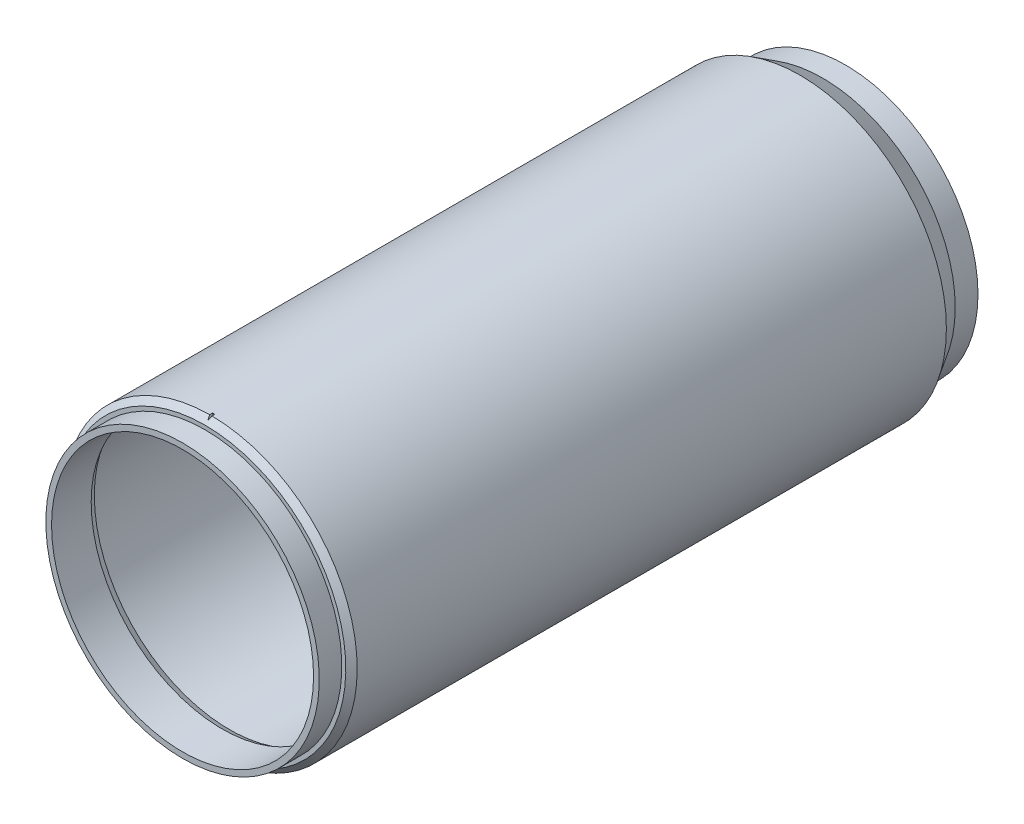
SolidWorks part; units mm, degrees
ref_plane "Front Plane" through (0, 0, 0) normal (0, 0, 1) x (1, 0, 0)
ref_plane "Top Plane" through (0, 0, 0) normal (0, 1, 0) x (1, 0, 0)
ref_plane "Right Plane" through (0, 0, 0) normal (1, 0, 0) x (0, 0, -1)
sketch "Sketch1" plane through (0, 0, 0) normal (0, 0, 1) x (1, 0, 0)
  circle A0 centre (0, 0) radius 95.25
  circle A1 centre (0, 0) radius 73.025
  dimension "D1" = 190.5
  dimension "D2" = 146.05
  dimension "D3" = 22.225
extrude "Extrude1" add sketch "Sketch1" along normal blind 378.6886
sketch "Sketch11" plane through (0, 0, 0) normal (1, 0, 0) x (0, 0, -1)
  line L1 (0, -95.25) -> (0, 95.25) construction
  line L2 (0, 58.549) -> (-3.8438, 57.15)
  line L3 (-3.8438, 57.15) -> (-23.495, 57.15)
  line L5 (-39.37, 92.6205) -> (0, 92.6205)
  line L7 (0, 0) -> (35.4678, 0) construction
  line L10 (-23.495, 57.15) -> (-39.37, 73.025)
  line L11 (0, 73.025) -> (-378.6886, 73.025) construction
  line L12 (-39.37, 73.025) -> (-39.37, 92.6205)
  line L13 (0, 92.6205) -> (0, 58.549)
  dimension "D1" = 39.37
  dimension "D2" = 114.3
  dimension "D4" = 45
  dimension "D5" = 20
revolve "Revolve1" add sketch "Sketch11" angle 360 about L7
sketch "Sketch4" plane through (0, 0, 0) normal (-1, 0, 0) x (0, 0, -1)
  line L1 (0, 95.25) -> (-378.6886, 95.25) construction
  line L2 (0, 81.5975) -> (-366.1156, 81.5975)
  line L3 (-366.1156, 81.5975) -> (-366.1156, 76.2)
  line L7 (0, 0) -> (-51.7665, 0) construction
  line L8 (-378.6886, 76.2) -> (-378.6886, 95.25)
  line L9 (-378.6886, 95.25) -> (-284.1625, 95.25)
  line L10 (-276.225, 95.25) -> (0, 95.25)
  line L11 (-369.3787, -73.025) -> (-381, -73.025) construction
  line L12 (-27.2857, -81.5975) -> (-366.1156, -81.5975) construction
  line L13 (-378.6886, 76.2) -> (-366.1156, 76.2)
  line L14 (-276.225, 95.25) -> (-284.1625, 95.25)
  line L16 (0, 95.25) -> (-378.6886, 95.25) construction
  line L18 (0, 81.5975) -> (0, 95.25)
  dimension "D1" = 163.195
  dimension "D2" = 12.573
  dimension "D7" = 152.4
revolve "Cut-Revolve1" cut sketch "Sketch4" angle 360 about L7
chamfer "Chamfer2" distance 3.175 angle 45 1 edges at (0, 81.5975, 366.1156)
sketch "Sketch7" [suppressed] plane through (0, 0, 0) normal (0, 0, 1) x (1, 0, 0)
  line L1 (-127.1207, 123.9041) -> (142.6954, 123.9041)
  line L2 (-127.1207, 123.9041) -> (-127.1207, -118.2423)
  line L3 (-127.1207, -118.2423) -> (142.6954, -118.2423)
  line L4 (142.6954, 123.9041) -> (142.6954, -118.2423)
extrude "FEA Cut" [suppressed] cut sketch "Sketch7" along normal blind 151.9089
sketch3d "CenterOfMass 10/16/2008 15:09:58"
  point P0 (0, 0, 147.9265)
sketch "Sketch12" plane through (0, 0, 0) normal (1, 0, 0) x (0, 0, -1)
  line L0 (0, 0) -> (30.6984, 0) construction
  line L2 (-9.1186, 50.4324) -> (0, 50.4324)
  line L3 (-9.1186, 50.4324) -> (-9.1186, 81.5975)
  line L4 (-9.1186, 81.5975) -> (0, 81.5975)
  line L5 (0, 50.4324) -> (0, 81.5975)
  dimension "D1" = 9.1186
revolve "Cut-Revolve2" cut sketch "Sketch12" angle 360 about L0
sketch "Sketch16" plane through (0, 0, 0) normal (1, 0, 0) x (0, 0, -1)
  line L0 (-356.5906, 73.025) -> (-352.4662, 75.4062)
  line L1 (-39.37, 73.025) -> (-378.6886, 73.025) construction
  line L2 (-352.4662, 75.4062) -> (-41.7512, 75.4062)
  line L3 (-41.7512, 75.4062) -> (-39.37, 73.025)
  line L4 (-39.37, 73.025) -> (-356.5906, 73.025)
  line L5 (-23.495, 57.15) -> (-39.37, 73.025) construction
  line L6 (-366.1156, 78.4225) -> (-366.1156, -78.4225) construction
  line L7 (0, 0) -> (-59.6395, 0) construction
  dimension "D1" = 30
  dimension "D2" = 9.525
  dimension "D3" = 150.8125
hole_wizard "#10-32 Tapped Hole1" positions "Sketch14" profile "Sketch13" tap size "#10-32" standard "ANSI Inch"
sketch "Sketch14" plane through (0, 0, 9.1186) normal (0, 0, -1) x (-1, 0, 0)
  circle A0 centre (0, 0) radius 66.675 construction
  point P0 (0, 66.675)
  dimension "D1" = 133.35
sketch "Sketch13" plane through (0, 66.675, 9.1186) normal (1, 0, 0) x (0, 1, 0)
  line L0 (0, 0) -> (0, 13.2783)
  line L1 (0, 13.2783) -> (2.0193, 12.065)
  line L2 (2.0193, 12.065) -> (2.0193, 0)
  line L5 (2.0193, 0) -> (0, 0)
  line L10 (0, 13.2783) -> (-2.0193, 12.065) construction
  line L11 (0, -6.35) -> (0, 107.95) construction
  dimension "Tap Drill Dia." = 4.0386
  dimension "Tap Drill Depth" = 12.065
  dimension "Drill Angle" = 118
pattern_circular "CirPattern1" count 8 over 360 about axis through (0, 0, 0) along (0, 0, 1) of "#10-32 Tapped Hole1"
sketch "Sketch15" plane through (0, 0, 0) normal (1, 0, 0) x (0, 0, -1)
  line L0 (-9.1186, 73.8188) -> (-34.5186, 81.5975) construction
  line L1 (-9.1186, -81.5975) -> (-9.1186, 81.5975) construction
  line L2 (-9.1186, 81.5975) -> (-362.9406, 81.5975) construction
  line L3 (-34.5186, 81.5975) -> (-9.1186, 81.5975)
  line L4 (-9.1186, 81.5975) -> (-9.1186, 73.8188)
  line L5 (0, 0) -> (27.4443, 0) construction
  line L6 (-9.1186, 73.8188) -> (-21.8186, 73.8188)
  line L7 (-21.8186, 73.8188) -> (-34.5186, 81.5975)
  dimension "D1" = 147.6375
  dimension "D2" = 25.4
  dimension "D3" = 12.7
  dimension "D4" = 31.487
revolve "Cut-Revolve3" cut sketch "Sketch15" angle 360 about L5
revolve "Cut-Revolve4" cut sketch "Sketch16" angle 360 about L7
sketch "Sketch17" plane through (0, 0, 0) normal (0, 0, 1) x (1, 0, 0)
  line L1 (0, 0) -> (-86.2333, 0)
  line L2 (0, 0) -> (0, 88.0376)
  line L3 (0, 88.0376) -> (-86.2333, 88.0376)
  line L4 (-86.2333, 0) -> (-86.2333, 88.0376)
extrude "FEA Cut-Extrude1" [suppressed] cut sketch "Sketch17" along normal through all flip side to cut
sketch "Sketch18" plane through (0, 0, 366.1156) normal (0, 0, 1) x (1, 0, 0)
  line L0 (-1.5706, 83.789) -> (0, 79.9973)
  line L1 (0, 79.9973) -> (1.5706, 83.789)
  line L2 (1.5706, 83.789) -> (-1.5706, 83.789)
  line L3 (0, 79.9973) -> (0, 83.789) construction
  circle A0 centre (0, 0) radius 81.5975 construction
  dimension "D1" = 79.9973
  dimension "D2" = 1.6002
  dimension "D3" = 45
extrude "Cut-Extrude2" cut sketch "Sketch18" against normal blind 4.7625
chamfer "Chamfer3" distance 1.5875 angle 20 1 edges at (-57.15, 0, 9.1186)
